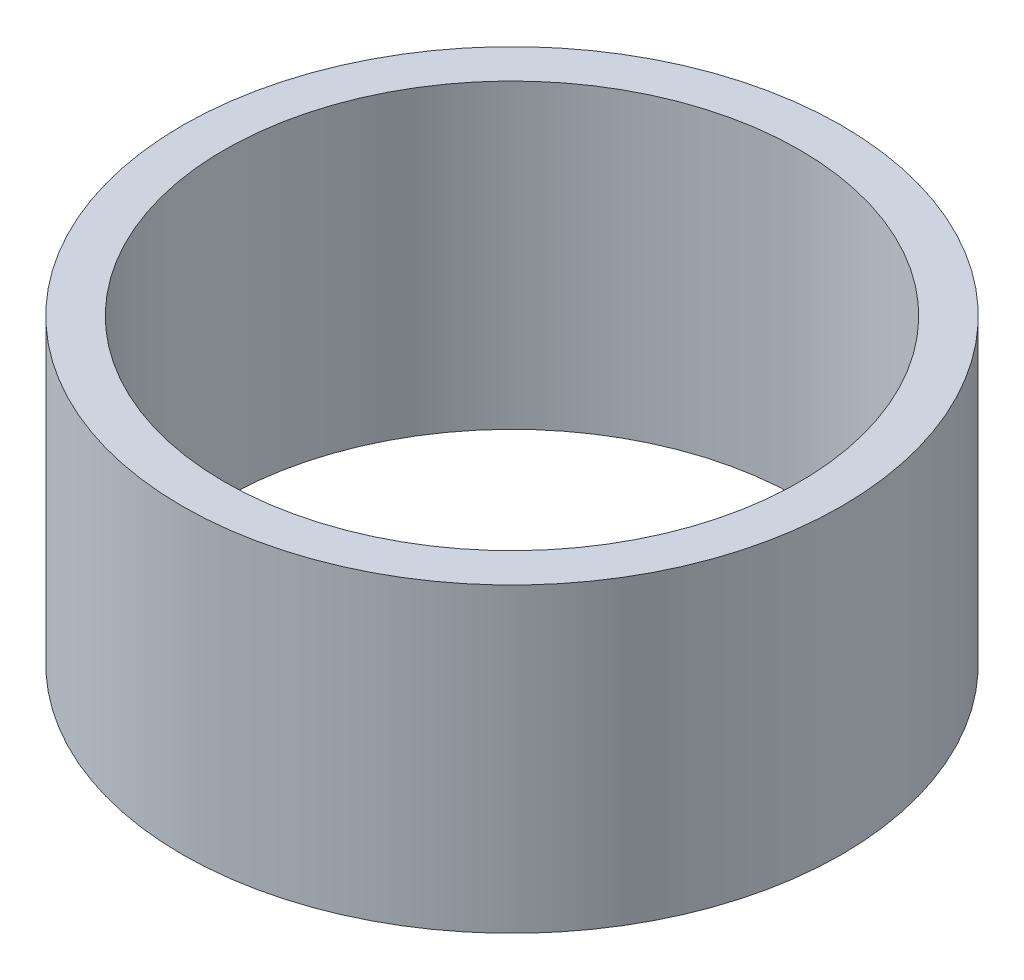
SolidWorks part; units mm, degrees
ref_plane "Face" through (0, 0, 0) normal (0, 0, 1) x (1, 0, 0)
ref_plane "Dessus" through (0, 0, 0) normal (0, 1, 0) x (1, 0, 0)
ref_plane "Droite" through (0, 0, 0) normal (1, 0, 0) x (0, 0, -1)
sketch "Esquisse1" plane through (0, 0, 0) normal (0, 0, 1) x (1, 0, 0)
  line L1 (20.5, 21.5) -> (23.5, 21.5)
  line L2 (20.5, 21.5) -> (20.5, 0)
  line L3 (20.5, 0) -> (23.5, 0)
  line L4 (23.5, 21.5) -> (23.5, 0)
  line L7 (0, 28.1201) -> (0, -6.7506) construction
  line L8 (0, 350) -> (0, -250) construction
  dimension "D1" = 23.5
  dimension "D2" = 3
  dimension "D3" = 21.5
revolve "Révolution1" add sketch "Esquisse1" angle 360 about L7
